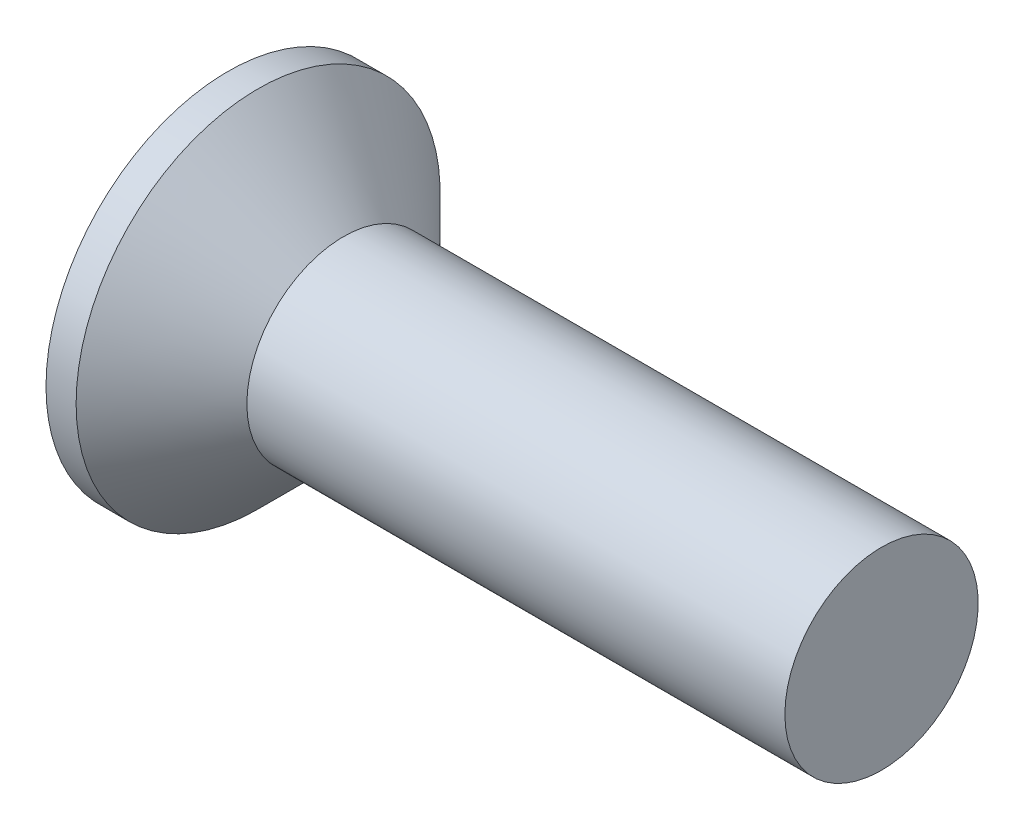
SolidWorks part; units mm, degrees
revolve "Base-Revolve" add sketch "BodySke" angle 360 about L4
sketch "BodySke" plane through (0, 0, 0) normal (0, 0, 1) x (1, 0, 0)
  line L0 (0, 0) -> (21.3974, 0)
  line L1 (21.3974, 0) -> (21.3974, 3)
  line L2 (21.3974, 3) -> (4.6974, 3)
  line L3 (4.6974, 3) -> (-4.1756, 11.873) construction
  line L4 (-15.875, 0) -> (82.55, 0) construction
  line L5 (4.6974, -3) -> (-4.1756, -11.873) construction
  line L6 (5.6974, 6.175) -> (5.6974, -9.7) construction
  line L7 (1.3974, 7.2375) -> (1.3974, -8.6375) construction
  line L8 (4.6974, 3) -> (2.0474, 5.65)
  line L9 (2.0474, 5.65) -> (1.1128, 5.65)
  arc A0 (0, 0) -> (1.1128, 5.65) centre (14.9, 0) cw
  arc A1 (1.3974, 6.3) -> (0, 0) centre (14.9, 0) ccw construction
ref_plane "Plane1" through (0, 0, 0) normal (0, 0, 1) x (1, 0, 0)
ref_plane "Plane2" through (0, 0, 0) normal (0, 1, 0) x (1, 0, 0)
ref_plane "Plane3" through (0, 0, 0) normal (1, 0, 0) x (0, 0, -1)
sketch "Sketch2" plane through (0, 0, 0) normal (1, 0, 0) x (0, 0, -1)
  line L0 (5.65, -0.95) -> (-5.65, -0.95)
  line L1 (5.65, -0.95) -> (5.65, 0.95)
  line L2 (-5.65, 0.95) -> (5.65, 0.95)
  line L3 (-5.65, 0.95) -> (-5.65, -0.95)
extrude "Slot" [suppressed] cut sketch "Sketch2" along normal blind 2.8
sketch "Sketch3" plane through (0, 0, 0) normal (1, 0, 0) x (0, 0, -1)
  line L0 (0.595, -3.65) -> (-0.595, -3.65)
  line L1 (0.595, -3.65) -> (0.595, 3.65)
  line L2 (-0.595, 3.65) -> (0.595, 3.65)
  line L3 (-0.595, 3.65) -> (-0.595, -3.65)
ref_plane "Plane4" through (4.26, 0, 0) normal (1, 0, 0) x (0, 0, -1)
sketch "Sketch4" plane through (4.26, 0, 0) normal (1, 0, 0) x (0, 0, -1)
  line L0 (0.2975, -0.2975) -> (-0.2975, -0.2975)
  line L1 (0.2975, -0.2975) -> (0.2975, 0.2975)
  line L2 (-0.2975, 0.2975) -> (0.2975, 0.2975)
  line L3 (-0.2975, 0.2975) -> (-0.2975, -0.2975)
loft "Cross" cut profiles "Sketch3", "Sketch4"
pattern_circular "CirPattern1" count 2 every 90 about axis through (0, 0, 0) along (1, 0, 0) of "Cross"
sketch "ThdSchSke" plane through (0, 0, 0) normal (0, 0, 1) x (1, 0, 0)
  line L0 (5.6974, -2.4455) -> (5.3091, -3)
  line L1 (5.6974, -2.4455) -> (6.0857, -3)
  line L2 (6.0857, -3) -> (6.0857, -3.75)
  line L3 (-3.175, 0) -> (5.1513, 0) construction
  line L5 (6.0857, -3.75) -> (5.3091, -3.75)
  line L6 (5.3091, -3.75) -> (5.3091, -3)
  line L8 (21.3974, -3) -> (21.3974, 3) construction
revolve "ThreadSchematic" [suppressed] cut sketch "ThdSchSke" angle 360 about L3
pattern_linear "ThdSchPat" [suppressed]
equation "\"D1@Sketch2\" = \"Head_dia@BodySke\""
equation "\"D3@Sketch2\" = \"D1@Sketch2\" / 2"
equation "\"D4@Sketch2\" = \"Slot_width@Sketch2\" / 2"
equation "\"D1@Sketch3\" = \"Cross_width@Sketch3\" / 2"
equation "\"D2@Sketch3\" = \"Cross_dia@Sketch3\" / 2"
equation "\"D1@Sketch4\" = \"Cross_width@Sketch3\"*.5"
equation "\"D2@Sketch4\" = \"D1@Sketch4\""
equation "\"D3@Sketch4\" = \"D1@Sketch4\" / 2"
equation "\"D4@Sketch4\" = \"D2@Sketch4\" / 2"
equation "\"Thread_length@ThreadCosmetic\" = ((sgn( (\"Length@BodySke\" - \"Advance@BodySke\" - \"Side_ht@BodySke\" ) - \"Thread_nom@BodySke\" )-1)*( (\"Length@BodySke\" - \"Advance@BodySke\" - \"Side_ht@BodySke\" ) - \"Thread_"
equation "\"Thread_minor@ThdSchSke\" = \"Thread_minor@ThreadCosmetic\""
equation "\"Diameter@ThdSchSke\" = \"Diameter@BodySke\""
equation "\"Overcut@ThdSchSke\" = \"Diameter@BodySke\" * 1.25"
equation "\"Start@ThdSchSke\" =  \"Thread_length@ThreadCosmetic\""
equation "\"Num_threads@ThdSchPat\" = int( \"Thread_length@ThreadCosmetic\" / \"Advance@BodySke\" + 0.999 )  + 1"
equation "\"Advance@ThdSchPat\" = \"Thread_length@ThreadCosmetic\" /  (\"Num_threads@ThdSchPat\" - 1) 'relax it"
